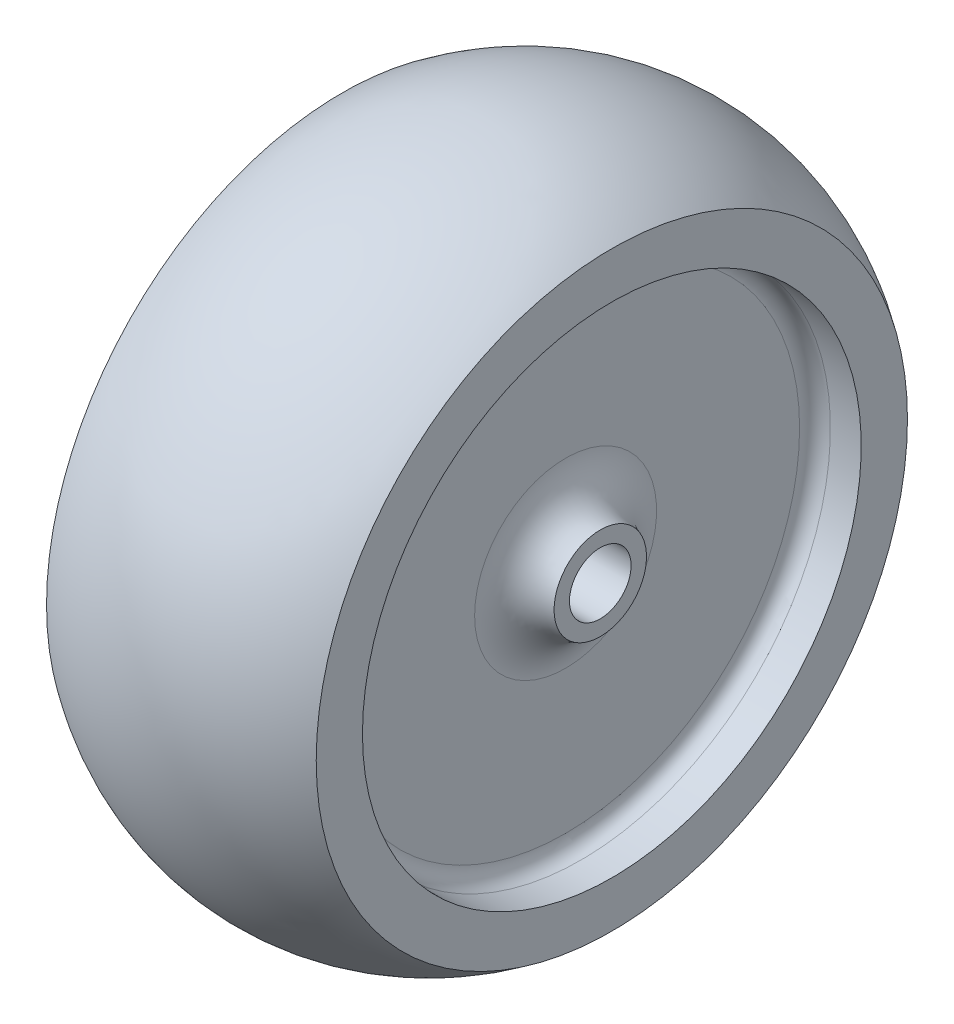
SolidWorks part; units mm, degrees
ref_plane "Front Plane" through (0, 0, 0) normal (0, 0, 1) x (1, 0, 0)
ref_plane "Top Plane" through (0, 0, 0) normal (0, 1, 0) x (1, 0, 0)
ref_plane "Right Plane" through (0, 0, 0) normal (1, 0, 0) x (0, 0, -1)
sketch "Sketch1" plane through (0, 0, 0) normal (0, 0, 1) x (1, 0, 0)
  line L0 (0, 0) -> (21.0336, 0) construction
  line L1 (-2.5, 4) -> (-2.5, 6)
  line L4 (-2.5, 4) -> (29.5, 4)
  line L6 (-2.5, 6) -> (0, 6)
  line L7 (-4, 32.367) -> (-4, 38.367)
  line L8 (31, 38.367) -> (31, 32.367)
  line L9 (27, 6) -> (29.5, 6)
  line L10 (29.5, 6) -> (29.5, 4)
  line L11 (13.5, 4) -> (13.5, 44) construction
  line L12 (0, 6) -> (2, 6)
  line L14 (-4, 32.367) -> (0, 32.367)
  line L15 (2, 6) -> (2, 30.367)
  line L16 (27, 6) -> (25, 6)
  line L18 (31, 32.367) -> (27, 32.367)
  line L19 (25, 6) -> (25, 30.367)
  line L20 (-2.5, 6) -> (-2.5, 12.4404) construction
  line L21 (-2.5, 12.4404) -> (2, 12.4404) construction
  line L22 (29.5, 6) -> (29.5, 12.4404) construction
  line L23 (29.5, 12.4404) -> (25, 12.4404) construction
  line L24 (31.5, 14) -> (31.5, -5.7087) construction
  line L26 (-4.5, 10.0525) -> (-4.5, -33.3391) construction
  arc A0 (-4, 38.367) -> (31, 38.367) centre (13.5, 14) cw
  arc A1 (27, 32.367) -> (25, 30.367) centre (27, 30.367) ccw
  arc A2 (0, 32.367) -> (2, 30.367) centre (0, 30.367) cw
  point P20 (25, 32.367)
  point P23 (2, 32.367)
  point P27 (13.5, 44)
  point P30 (0, 0)
  point P31 (28.575, 6)
  point P32 (29.4812, 6)
  point P33 (-2.1193, 6)
  point P35 (-3.0369, 6)
  point P36 (0.4997, 6)
  point P37 (-2.8668, 6)
  point P38 (28.9045, 6)
  point P43 (3.5, 6)
  point P44 (23.5, 6)
  point P45 (0, 6)
  dimension "D11" = 30
  dimension "D12" = 2
  dimension "D1" = 8
  dimension "D2" = 2
  dimension "D3" = 35
  dimension "D4" = 2
  dimension "D5" = 12
  dimension "D6" = 12
  dimension "D7" = 6
  dimension "D8" = 6
  dimension "D9" = 6
  dimension "D10" = 40
revolve "Revolve1" add sketch "Sketch1" angle 360 about L0
fillet "Fillet1" radius 6 2 edges at (25, 0, 6) (2, 0, 6)
